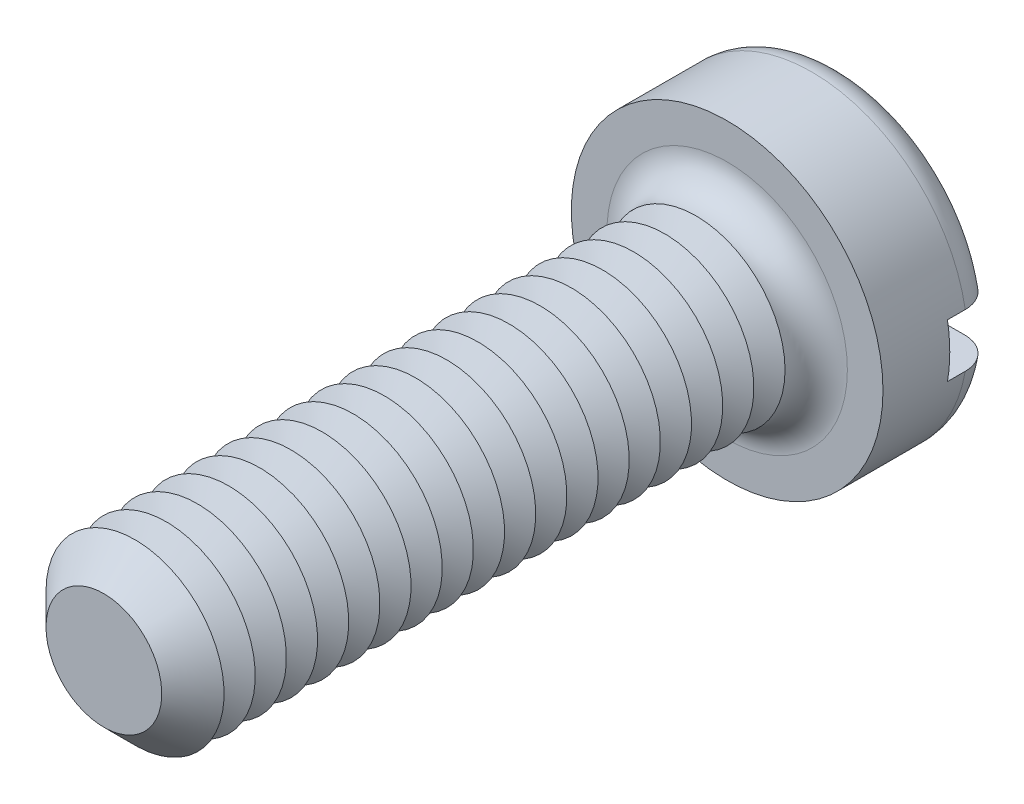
SolidWorks part; units mm, degrees
ref_plane "Front Plane" through (0, 0, 0) normal (0, 0, 1) x (1, 0, 0)
ref_plane "Top Plane" through (0, 0, 0) normal (0, 1, 0) x (1, 0, 0)
ref_plane "Right Plane" through (0, 0, 0) normal (1, 0, 0) x (0, 0, -1)
sketch "Sketch3" plane through (0, 0, 0) normal (0, 0, 1) x (1, 0, 0)
  circle A0 centre (0, 0) radius 3.5
  dimension "D1" = 7
extrude "Boss-Extrude2" add sketch "Sketch3" against normal blind 2.6
sketch "Sketch4" plane through (0, 0, 0) normal (0, 0, 1) x (1, 0, 0)
  circle A0 centre (0, 0) radius 2
  dimension "D1" = 4
extrude "Boss-Extrude3" add sketch "Sketch4" along normal blind 14
fillet "Fillet1" radius 0.7 2 edges at (3.5, 0, -2.6) (2, 0, 0)
chamfer "Chamfer1" distance 0.7 angle 45 1 edges at (2, 0, 14)
sketch "Sketch5" plane through (0, 0, 0) normal (1, 0, 0) x (0, 0, -1)
  line L0 (1.6944, 0) -> (-7.6738, 0) construction
sketch "Sketch6" plane through (0, 0, 0) normal (1, 0, 0) x (0, 0, -1)
  line L0 (-0.7, 2) -> (-1.05, 1.3938)
  line L1 (-1.05, 1.3938) -> (-1.4, 2)
  line L2 (-0.7, 2) -> (-13.3, 2) construction
  line L3 (-1.4, 2) -> (-0.7, 2)
  dimension "D1" = 0.7
revolve "Cut-Revolve1" cut sketch "Sketch6" angle 360 about L0
pattern_linear "LPattern1" count 18 spacing 0.7 along (0, 0, 1) of "Cut-Revolve1"
sketch "Sketch8" plane through (0, 0, -2.6) normal (0, 0, -1) x (-1, 0, 0)
  line L1 (3.5, -0.6) -> (-3.5, -0.6)
  line L2 (3.5, -0.6) -> (3.5, 0.6)
  line L3 (3.5, 0.6) -> (-3.5, 0.6)
  line L4 (-3.5, -0.6) -> (-3.5, 0.6)
  line L5 (3.5, -0.6) -> (-3.5, 0.6) construction
  line L6 (3.5, 0.6) -> (-3.5, -0.6) construction
  point P0 (0, 0)
  dimension "D1" = 7
  dimension "D2" = 1.2
extrude "Cut-Extrude1" cut sketch "Sketch8" against normal blind 1.1
